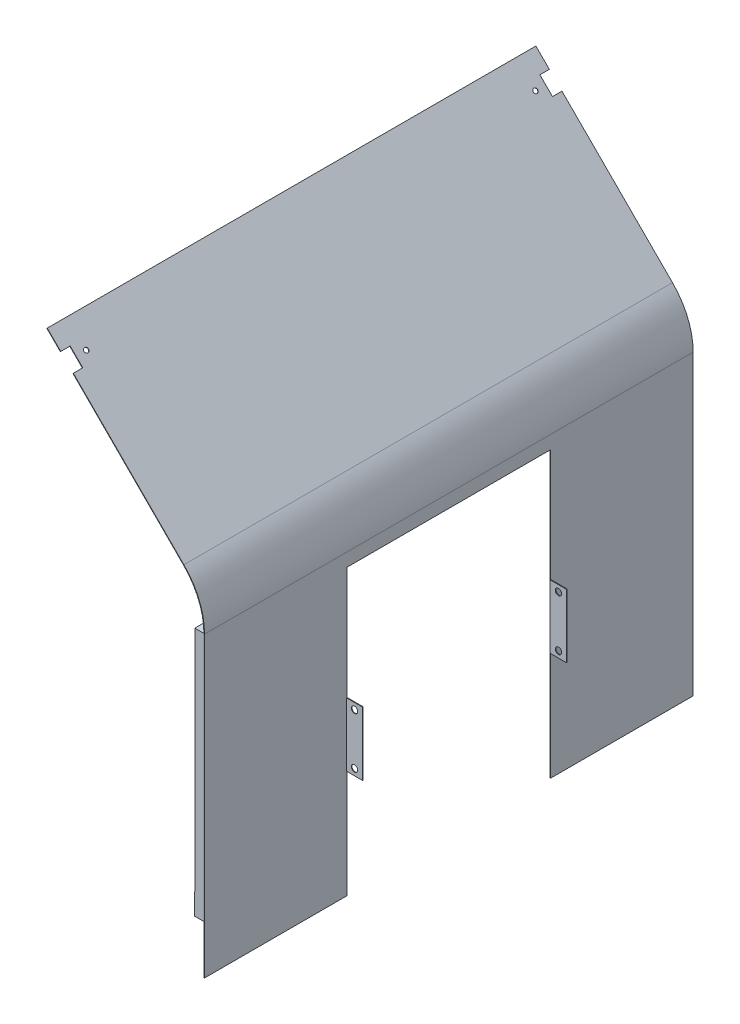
SolidWorks part; units mm, degrees
ref_plane "Plan de face" through (0, 0, 0) normal (0, 0, 1) x (1, 0, 0)
ref_plane "Plan de dessus" through (0, 0, 0) normal (0, 1, 0) x (1, 0, 0)
ref_plane "Plan de droite" through (0, 0, 0) normal (1, 0, 0) x (0, 0, -1)
sketch "Esquisse3" plane through (0, 0, 0) normal (0, 0, 1) x (1, 0, 0)
  line L0 (1010, -10) -> (1010, 458.5786) construction
  line L1 (977.7817, 536.3604) -> (803.7598, 710.3824) construction
  line L2 (1010, -10) -> (1010, 458.5786)
  line L3 (977.7817, 536.3604) -> (803.7598, 710.3824)
  arc A0 (1010, 458.5786) -> (977.7817, 536.3604) centre (900, 458.5786) ccw construction
  arc A1 (1010, 458.5786) -> (977.7817, 536.3604) centre (900, 458.5786) ccw
extrude "Extru.-Mince1" add sketch "Esquisse3" along normal up to surface (769 mm away) thin
sketch "Esquisse4" plane through (1010, 0, 0) normal (-1, 0, 0) x (0, 0, 1)
  line L0 (698.3705, 458.5786) -> (0.4986, 458.5786)
  line L2 (769, 458.5786) -> (0, 458.5786) construction
extrude "Extru.-Mince2" add sketch "Esquisse4" along normal blind 15 thin
sketch "Esquisse7" plane through (1010, 0, 0) normal (-1, 0, 0) x (0, 0, 1)
  line L0 (698.3705, 458.5786) -> (0.4986, 458.5786) construction
  line L2 (768.5, 65.9629) -> (697.6, 65.9629)
  line L3 (697.6, 458.5786) -> (697.6, 65.9629)
  line L5 (697.6, 458.5786) -> (768.3705, 458.5786)
  line L6 (769, 458.5786) -> (769, -10) construction
  line L7 (768.3705, 458.5786) -> (768.5, 65.9629)
sketch "Esquisse9" plane through (1010, 0, 0) normal (-1, 0, 0) x (0, 0, 1)
  line L0 (769, -10) -> (0, -10) construction
  line L1 (224.5, -10) -> (544.5, -10)
  line L2 (224.5, -10) -> (224.5, 437.7492)
  line L3 (224.5, 437.7492) -> (544.5, 437.7492)
  line L4 (544.5, -10) -> (544.5, 437.7492)
  line L8 (0, -10) -> (0, 458.5786) construction
  point P9 (0, 224.2893)
  dimension "D1" = 320
  dimension "D2" = 224.5
  dimension "D3" = 447.7492
extrude "Enlèv. mat.-Extru.1" cut sketch "Esquisse9" against normal blind 10
sketch "Esquisse10" plane through (1010, 0, 0) normal (-1, 0, 0) x (0, 0, 1)
  line L0 (224.5, 437.7492) -> (224.5, -10) construction
  line L1 (224.5, 260.04) -> (223.5, 260.04)
  line L2 (224.5, 260.04) -> (224.5, 160.04)
  line L3 (224.5, 160.04) -> (223.5, 160.04)
  line L4 (223.5, 260.04) -> (223.5, 160.04)
  line L5 (544.5, -10) -> (544.5, 437.7492) construction
  line L6 (544.5, 260.04) -> (545.5, 260.04)
  line L7 (544.5, 260.04) -> (544.5, 160.04)
  line L8 (544.5, 160.04) -> (545.5, 160.04)
  line L9 (545.5, 260.04) -> (545.5, 160.04)
  dimension "D1" = 1
  dimension "D2" = 1
  dimension "D3" = 100
  dimension "D4" = 100
  dimension "D5" = 270.04
extrude "Extrusion1" add sketch "Esquisse10" against normal blind 26
sketch "Esquisse11" plane through (0, 0, 545.5) normal (0, 0, 1) x (1, 0, 0)
  line L0 (1036, 260.04) -> (1010.9, 260.04) construction
  line L1 (1036, 160.04) -> (1036, 260.04) construction
  circle A0 centre (1023.5, 250.04) radius 5
  circle A1 centre (1023.5, 170.04) radius 5
  point P4 (1023.45, 260.04)
  dimension "D1" = 10
  dimension "D2" = 10
  dimension "D3" = 10
  dimension "D4" = 80
  dimension "D5" = 12.5
  dimension "D6" = 12.5
extrude "Enlèv. mat.-Extru.2" cut sketch "Esquisse11" against normal blind 376
sketch "Esquisse12" plane through (46.6887, -46.6887, 0) normal (-0.7071, 0.7071, 0) x (-0.7071, -0.7071, 0)
  line L0 (-1071.5602, 769) -> (-1071.5602, 0) construction
  line L1 (-1071.5602, 14.8496) -> (-1070.6602, 14.8496)
  line L2 (-1071.5602, 14.8496) -> (-1071.5602, 754.16)
  line L3 (-1071.5602, 754.16) -> (-1070.6602, 754.16)
  line L4 (-1070.6602, 14.8496) -> (-1070.6602, 754.16)
  dimension "D1" = 0.9
  dimension "D2" = 14.84
extrude "Extrusion2" add sketch "Esquisse12" along normal up to vertex (28 mm away)
sketch "Esquisse13" plane through (26.8897, -26.8897, 0) normal (-0.7071, 0.7071, 0) x (-0.7071, -0.7071, 0)
  line L1 (-1070.6602, 0) -> (-1071.5602, 0) construction
  line L2 (-1071.5602, 769) -> (-1070.6602, 769) construction
  line L4 (-1071.5602, 754.16) -> (-1071.5602, 14.8496)
  line L5 (-1071.5602, 14.8496) -> (-1070.6602, 14.8496)
  line L6 (-1070.6602, 14.8496) -> (-1070.6602, 754.16)
  line L7 (-1070.6602, 754.16) -> (-1071.5602, 754.16)
  line L8 (-1071.5602, 769) -> (-1071.5602, 0)
  line L9 (-1071.5602, 0) -> (-1070.6602, 0)
  line L10 (-1070.6602, 0) -> (-1070.6602, 769)
  line L11 (-1070.6602, 769) -> (-1071.5602, 769)
  dimension "D1" = 0
extrude "Extrusion3" add sketch "Esquisse13" along normal blind 30
sketch "Esquisse15" plane through (757.0711, 757.0711, 0) normal (-0.7071, -0.7071, 0) x (0.7071, -0.7071, 0)
  circle A0 centre (51.0278, 738) radius 3.5
  circle A1 centre (51.0278, 31) radius 3.5
  dimension "D1" = 7
  dimension "D2" = 7
extrude "Enlèv. mat.-Extru.4" cut sketch "Esquisse15" against normal blind 10
sketch "Esquisse16" plane through (1010, 0, 0) normal (-1, 0, 0) x (0, 0, 1)
  line L0 (0.4986, 458.5786) -> (0.4986, 65.9629)
  line L4 (0, -10) -> (0, 458.5786) construction
extrude "Extru.-Mince9" add sketch "Esquisse16" along normal blind 15 thin
extrude "Extrusion6" add sketch "Esquisse7" along normal up to vertex (15 mm away)
